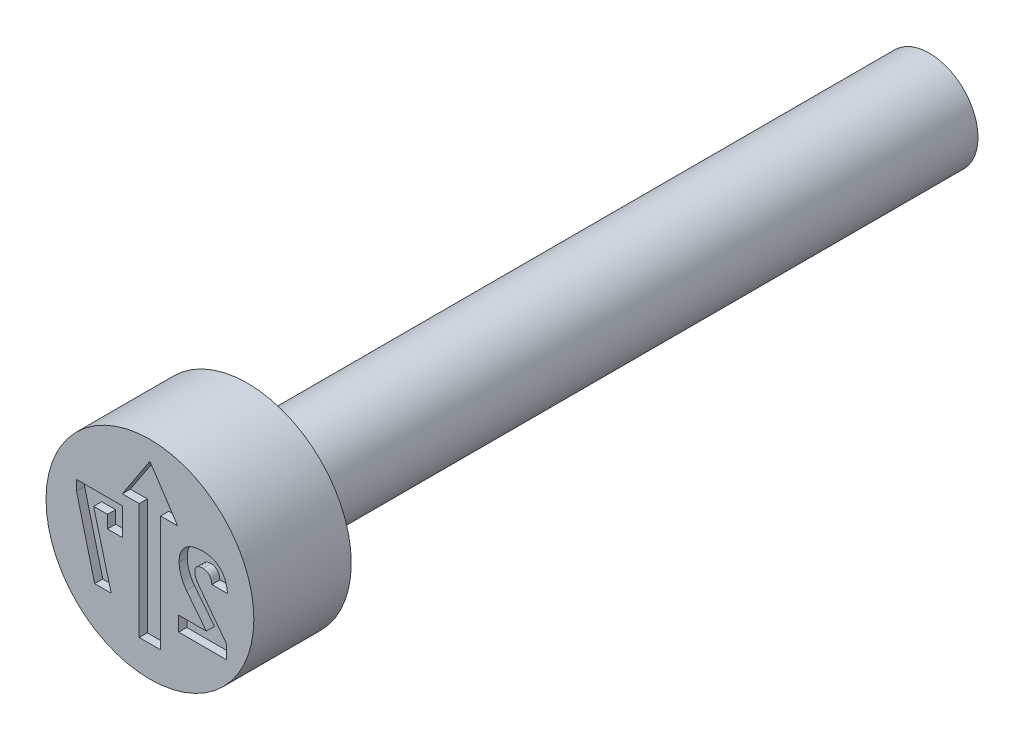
SolidWorks part; units mm, degrees
ref_plane "Front Plane" through (0, 0, 0) normal (0, 0, 1) x (1, 0, 0)
ref_plane "Top Plane" through (0, 0, 0) normal (0, 1, 0) x (1, 0, 0)
ref_plane "Right Plane" through (0, 0, 0) normal (1, 0, 0) x (0, 0, -1)
imported_body "Imported1"
sketch "Sketch1" plane through (0, 0, -0.569) normal (0, 0, 1) x (1, 0, 0)
  line L7 (0.8513, 1.3208) -> (0, 2.613)
  line L8 (0, 2.613) -> (-0.8513, 1.3208)
  line L9 (-0.8513, 1.3208) -> (-0.33, 1.3208)
  line L10 (-0.33, 1.3208) -> (-0.33, -2.25)
  line L11 (-0.33, -2.25) -> (0.33, -2.25)
  line L12 (0.33, -2.25) -> (0.33, 1.3208)
  line L13 (0.33, 1.3208) -> (0.8513, 1.3208)
  line L14 (0.8513, 1.3208) -> (0, 2.613)
  line L15 (0, 2.613) -> (-0.8513, 1.3208)
  line L16 (-0.8513, 1.3208) -> (-0.33, 1.3208)
  line L17 (-0.33, 1.3208) -> (-0.33, -2.25)
  line L18 (-0.33, -2.25) -> (0.33, -2.25)
  line L19 (0.33, -2.25) -> (0.33, 1.3208)
  line L20 (0.33, 1.3208) -> (0.8513, 1.3208)
  dimension "D1" = 0
sketch "Sketch3" plane through (0, 0, 0) normal (0, 1, 0) x (1, 0, 0)
  line L0 (1.75, 24) -> (-1.75, 24) construction
  line L1 (1.5, 24) -> (1.75, 24)
  line L2 (1.5, 24) -> (1.5, 3)
  line L3 (1.5, 3) -> (1.75, 3)
  line L4 (1.75, 24) -> (1.75, 3)
  line L5 (3.2, 3) -> (-3.2, 3) construction
  line L6 (0, 24) -> (0, 25.7321) construction
  dimension "D1" = 3
  dimension "D2" = 0.25
revolve "Cut-Revolve1" cut sketch "Sketch3" angle 360 about L6
sketch "Sketch2" plane through (0, 0, 0) normal (0, 0, 1) x (1, 0, 0)
  text T0 "2  7" font "Bahnschrift" height 2.5
  dimension "D1" = 1.5
extrude "Cut-Extrude2" cut sketch "Sketch2" against normal blind 0.25
extrude "Boss-Extrude2" add sketch "Sketch1" along normal blind 0.32
